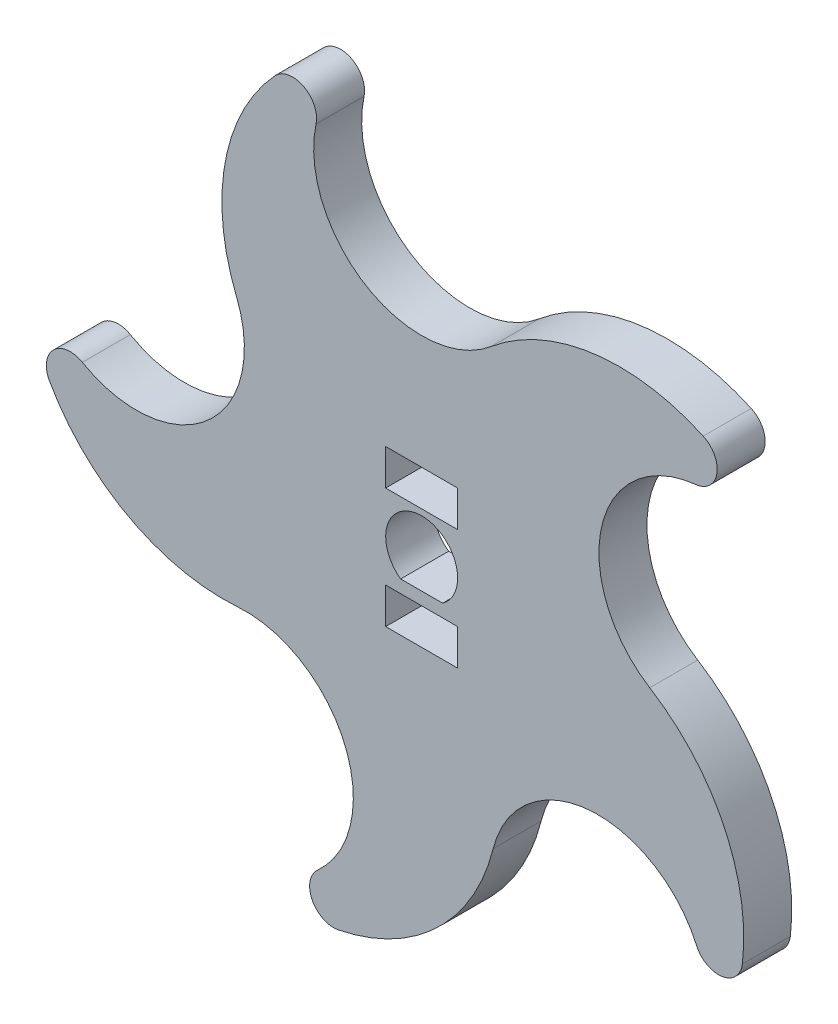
SolidWorks part; units mm, degrees
ref_plane "前视基准面" through (0, 0, 0) normal (0, 0, 1) x (1, 0, 0)
ref_plane "上视基准面" through (0, 0, 0) normal (0, 1, 0) x (1, 0, 0)
ref_plane "右视基准面" through (0, 0, 0) normal (1, 0, 0) x (0, 0, -1)
sketch "草图1" plane through (0, 0, 0) normal (0, 0, 1) x (1, 0, 0)
  line L0 (0, 0) -> (-23.7764, 7.7254) construction
  circle A0 centre (0, 0) radius 12.5
  circle A1 centre (0, 25) radius 12.5
  circle A2 centre (23.7764, 7.7254) radius 12.5
  circle A3 centre (14.6946, -20.2254) radius 12.5
  circle A4 centre (-14.6946, -20.2254) radius 12.5
  circle A5 centre (-23.7764, 7.7254) radius 12.5
  circle A6 centre (-23.7764, 7.7254) radius 10.5
  circle A7 centre (0, 25) radius 10.5
  circle A8 centre (23.7764, 7.7254) radius 10.5
  circle A9 centre (-14.6946, -20.2254) radius 10.5
  circle A10 centre (14.6946, -20.2254) radius 10.5
  circle A11 centre (-23.7764, 7.7254) radius 9
  circle A12 centre (0, 25) radius 9
  circle A13 centre (23.7764, 7.7254) radius 9
  circle A14 centre (14.6946, -20.2254) radius 9
  circle A15 centre (-14.6946, -20.2254) radius 9
  circle A17 centre (0, 0) radius 35.5
  point P16 (0, 0)
  dimension "D1" = 25
  dimension "D2" = 25
  dimension "D4" = 21
  dimension "D5" = 21
  dimension "D6" = 21
  dimension "D7" = 21
  dimension "D8" = 18
  dimension "D11" = 21
  dimension "D3" = 5
  dimension "D10" = 25
  dimension "D9" = 5
sketch "草图2" plane through (0, 0, 0) normal (0, 0, 1) x (1, 0, 0)
  line L10 (0, 0) -> (-16.5005, 5.3613) construction
  circle A26 centre (-14.6946, -20.2254) radius 9 construction
  arc A27 (-8.677, -26.9178) -> (-15.3282, -11.2478) centre (-14.6946, -20.2254) ccw
  circle A28 centre (0, 25) radius 9 construction
  circle A29 centre (14.6946, -20.2254) radius 9 construction
  circle A30 centre (23.7764, 7.7254) radius 9 construction
  circle A31 centre (-23.7764, 7.7254) radius 9 construction
  arc A32 (-8.8021, 26.8772) -> (5.7895, 18.1093) centre (0, 25) ccw
  arc A33 (22.919, -16.5704) -> (5.9606, -18.0538) centre (14.6946, -20.2254) ccw
  arc A34 (22.8418, 16.6768) -> (19.0121, 0.0899) centre (23.7764, 7.7254) ccw
  arc A35 (-28.2817, -0.0657) -> (-15.4339, 11.1023) centre (-23.7764, 7.7254) ccw
  arc A36 (-31.0279, -2.7743) -> (-15.3282, -11.2478) centre (-16.5005, 5.3613) ccw
  arc A37 (-28.2817, -0.0657) -> (-31.0279, -2.7743) centre (-29.2829, -1.7971) ccw
  arc A38 (-8.8021, 26.8772) -> (-12.2267, 28.652) centre (-10.7581, 27.2944) ccw
  arc A39 (-12.2267, 28.652) -> (-15.4339, 11.1023) centre (0, 17.3496) ccw
  arc A40 (22.8418, 16.6768) -> (23.4714, 20.4822) centre (22.6341, 18.6659) ccw
  arc A41 (23.4714, 20.4822) -> (5.7895, 18.1093) centre (16.5005, 5.3613) ccw
  arc A42 (22.919, -16.5704) -> (26.7328, -15.9933) centre (24.7467, -15.7582) ccw
  arc A43 (26.7328, -15.9933) -> (19.0121, 0.0899) centre (10.1978, -14.0361) ccw
  arc A44 (-8.677, -26.9178) -> (-6.9496, -30.3666) centre (-7.3398, -28.405) ccw
  arc A45 (-6.9496, -30.3666) -> (5.9606, -18.0538) centre (-10.1978, -14.0361) ccw
  dimension "D1" = 4
extrude "凸台-拉伸1" add sketch "草图2" along normal blind 4
sketch "草图3" plane through (0, 0, 4) normal (0, 0, 1) x (1, 0, 0)
  line L11 (3, 3.5) -> (-3, 3.5)
  line L14 (-3, 3.5) -> (-3, 6.5)
  line L15 (-3, 6.5) -> (3, 6.5)
  line L16 (3, 6.5) -> (3, 3.5)
  line L17 (3, -3.5) -> (-3, -3.5)
  line L18 (-3, -3.5) -> (-3, -6.5)
  line L19 (-3, -6.5) -> (3, -6.5)
  line L20 (3, -6.5) -> (3, -3.5)
  line L21 (1.75, -2.4367) -> (-1.75, -2.4367)
  arc A3 (1.75, -2.4367) -> (-1.75, -2.4367) centre (0, 0) ccw
  point P6 (0, 3.5)
  point P12 (0, -3.5)
  dimension "D1" = 6
  dimension "D4" = 6
  dimension "D7" = 3.5
  dimension "D2" = 3.5
  dimension "D3" = 3
  dimension "D5" = 3
  dimension "D6" = 6
  dimension "D8" = 3.5
extrude "切除-拉伸1" cut sketch "草图3" against normal blind 10
